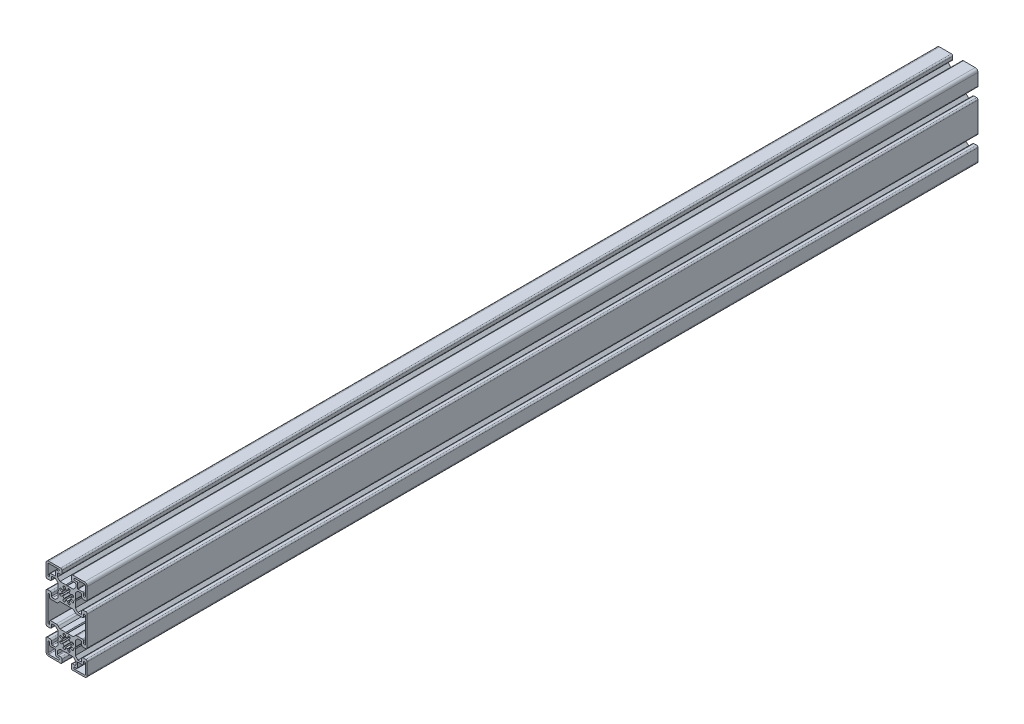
SolidWorks part; units mm, degrees
ref_plane "Front Plane" through (0, 0, 0) normal (0, 0, 1) x (1, 0, 0)
ref_plane "Top Plane" through (0, 0, 0) normal (0, 1, 0) x (1, 0, 0)
ref_plane "Right Plane" through (0, 0, 0) normal (1, 0, 0) x (0, 0, -1)
ref_plane "RIGHT" through (0, 0, 0) normal (1, 0, 0) x (0, 1, 0)
ref_plane "TOP" through (0, 0, 0) normal (0, 1, 0) x (0, 0, 1)
ref_plane "FRONT" through (0, 0, 0) normal (0, 0, 1) x (1, 0, 0)
imported_body "Imported1"
sketch "Sketch3" plane through (0, 0, -3048) normal (0, 0, -1) x (-1, 0, 0)
  line L1 (-27.6433, 52.7338) -> (26.0387, 52.7338)
  line L2 (-27.6433, 52.7338) -> (-27.6433, -50.3998)
  line L3 (-27.6433, -50.3998) -> (26.0387, -50.3998)
  line L4 (26.0387, 52.7338) -> (26.0387, -50.3998)
extrude "Cut-Extrude2" cut sketch "Sketch3" against normal blind 2075.688
